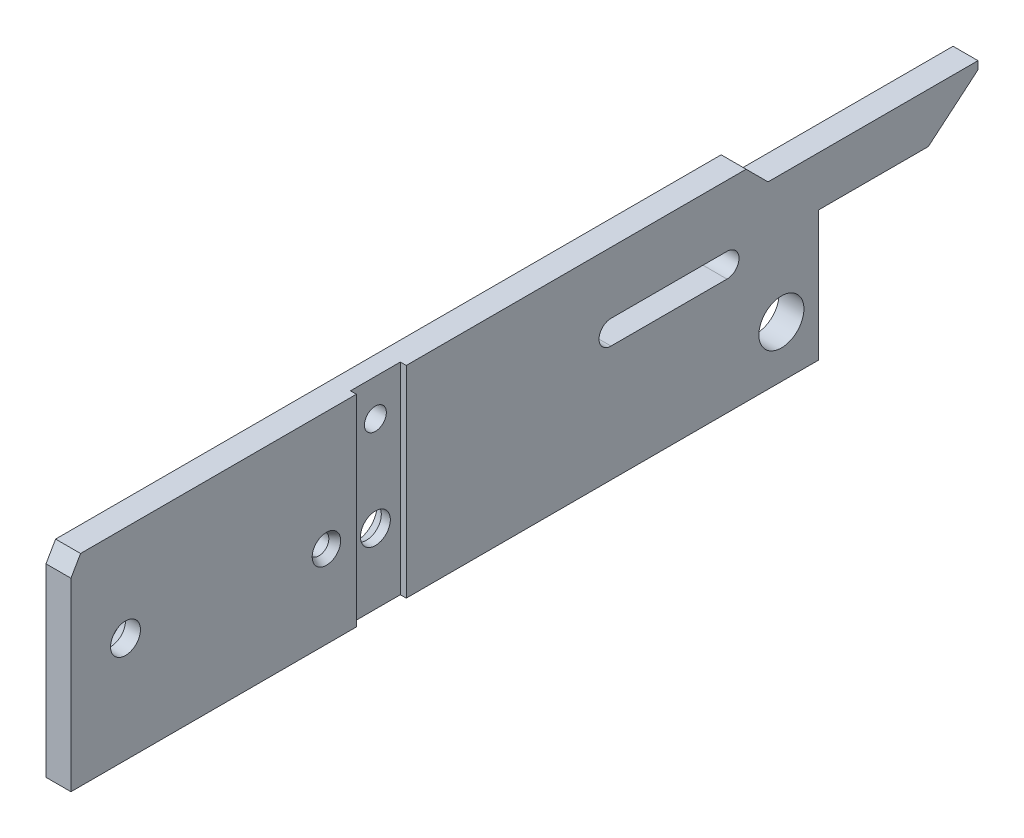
SolidWorks part; units mm, degrees
ref_plane "Спереди" through (0, 0, 0) normal (0, 0, 1) x (1, 0, 0)
ref_plane "Сверху" through (0, 0, 0) normal (0, 1, 0) x (1, 0, 0)
ref_plane "Справа" through (0, 0, 0) normal (1, 0, 0) x (0, 0, -1)
sketch "Эскиз1" plane through (0, 0, 0) normal (1, 0, 0) x (0, 0, -1)
  line L0 (-112.8014, -8.2042) -> (5.9182, -8.2042)
  line L1 (5.9182, -8.2042) -> (5.9182, 12.446)
  line L2 (5.9182, 12.446) -> (23.3284, 12.446)
  line L3 (23.3284, 12.446) -> (31.2166, 19.065)
  line L4 (31.2166, 19.065) -> (31.2166, 20.32)
  line L5 (31.2166, 20.32) -> (-2.1209, 20.32)
  line L6 (-2.1209, 20.32) -> (-5.6007, 23.7998)
  line L7 (-5.6007, 23.7998) -> (-111.2774, 23.7998)
  line L8 (-111.2774, 23.7998) -> (-112.8014, 21.1602)
  line L9 (-112.8014, 21.1602) -> (-112.8014, -8.2042)
  line L10 (-27.051, 12.1158) -> (-8.636, 12.1158) construction
  line L11 (-27.051, 14.0208) -> (-8.636, 14.0208)
  line L12 (-27.051, 10.2108) -> (-8.636, 10.2108)
  circle A0 centre (0, 0) radius 3.575
  circle A1 centre (-63.5254, 2.921) radius 2.3749
  circle A2 centre (-63.5254, 17.9832) radius 1.7399
  circle A3 centre (-72.2376, 4.9276) radius 1.5748
  circle A4 centre (-104.14, 8.5852) radius 2.3749
  arc A5 (-27.051, 14.0208) -> (-27.051, 10.2108) centre (-27.051, 12.1158) ccw
  arc A6 (-8.636, 10.2108) -> (-8.636, 14.0208) centre (-8.636, 12.1158) ccw
  point P23 (-17.8435, 12.1158)
  point P28 (-6.731, 12.1158)
  point P29 (-28.956, 12.1158)
  dimension "D4" = 7.1501
  dimension "D22" = 4.7498
  dimension "D23" = 3.1496
  dimension "D24" = 3.4798
  dimension "D1" = 7.874
  dimension "D2" = 50
  dimension "D3" = 5.461
  dimension "D5" = 8.2042
  dimension "D6" = 112.8014
  dimension "D7" = 30
  dimension "D8" = 45
  dimension "D9" = 118.7196
  dimension "D10" = 28.5242
  dimension "D11" = 144.018
  dimension "D12" = 33.3375
  dimension "D13" = 32.004
  dimension "D14" = 1.524
  dimension "D15" = 16.7894
  dimension "D16" = 13.1318
  dimension "D17" = 11.1252
  dimension "D18" = 15.0622
  dimension "D19" = 63.5254
  dimension "D20" = 72.2376
  dimension "D21" = 104.14
  dimension "D25" = 3.81
  dimension "D26" = 20.32
  dimension "D27" = 6.731
  dimension "D28" = 22.225
extrude "Бобышка-Вытянуть1" add sketch "Эскиз1" along normal blind 3.9624
sketch "Эскиз2" plane through (3.9624, 0, 0) normal (1, 0, 0) x (0, 0, -1)
  line L0 (-5.6007, 23.7998) -> (-111.2774, 23.7998) construction
  line L1 (-59.563, 23.7998) -> (-67.4878, 23.7998)
  line L2 (-59.563, 23.7998) -> (-59.563, -8.2042)
  line L3 (-59.563, -8.2042) -> (-67.4878, -8.2042)
  line L4 (-67.4878, 23.7998) -> (-67.4878, -8.2042)
  line L5 (-112.8014, -8.2042) -> (5.9182, -8.2042) construction
  line L6 (-63.5254, 17.9832) -> (-63.5254, 2.921) construction
  dimension "D1" = 7.9248
extrude "Вырез-Вытянуть1" cut sketch "Эскиз2" against normal offset from surface (0.9398 mm away) 3.0226
chamfer "Фаска1" distance 1.5875 angle 30 2 edges at (0, 2.921, 61.1505) (0, 8.5852, 101.7651)
chamfer "Фаска2" distance 1.1906 angle 30 1 edges at (3.9624, 4.9276, 70.6628)
